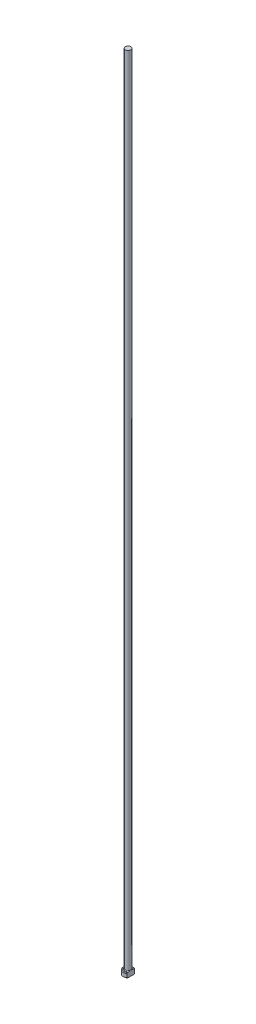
SolidWorks part; units mm, degrees
ref_plane "Front Plane" through (0, 0, 0) normal (0, 0, 1) x (1, 0, 0)
ref_plane "Top Plane" through (0, 0, 0) normal (0, 1, 0) x (1, 0, 0)
ref_plane "Right Plane" through (0, 0, 0) normal (1, 0, 0) x (0, 0, -1)
sketch "Sketch1" plane through (0, 0, 0) normal (0, 0, 1) x (1, 0, 0)
  line L0 (0, 259.9588) -> (0, -15.1925) construction
  line L1 (0, 0) -> (-1.5, 0)
  line L2 (-1.5, 0) -> (-1.5, 1.5)
  line L3 (-1.5, 1.5) -> (-0.85, 1.5)
  line L4 (-0.85, 1.5) -> (-0.85, 250)
  line L5 (-0.85, 250) -> (0, 250)
  line L6 (0, 250) -> (0, 0)
  dimension "L" = 250
  dimension "H" = 3
  dimension "T" = 1.5
  dimension "D" = 1.7
revolve "Revolve1" add sketch "Sketch1" angle 360 about L0
chamfer "Chamfer1" distance 0.2 angle 45 2 edges at (0, 1.5, 1.5) (0, 0, 1.5)
fillet "Fillet1" radius 0.2 1 edges at (0, 1.5, 0.85)
sketch "Sketch2" plane through (0, 0, 0) normal (0, 1, 0) x (1, 0, 0)
  line L0 (0.85, 1.2359) -> (0.85, -1.2359)
  circle A0 centre (0, 0) radius 1.5 construction
  arc A1 (0.85, -1.2359) -> (0.85, 1.2359) centre (0, 0) ccw
  circle A2 centre (0, 0) radius 0.85 construction
extrude "KEY" cut sketch "Sketch2" along normal through all
